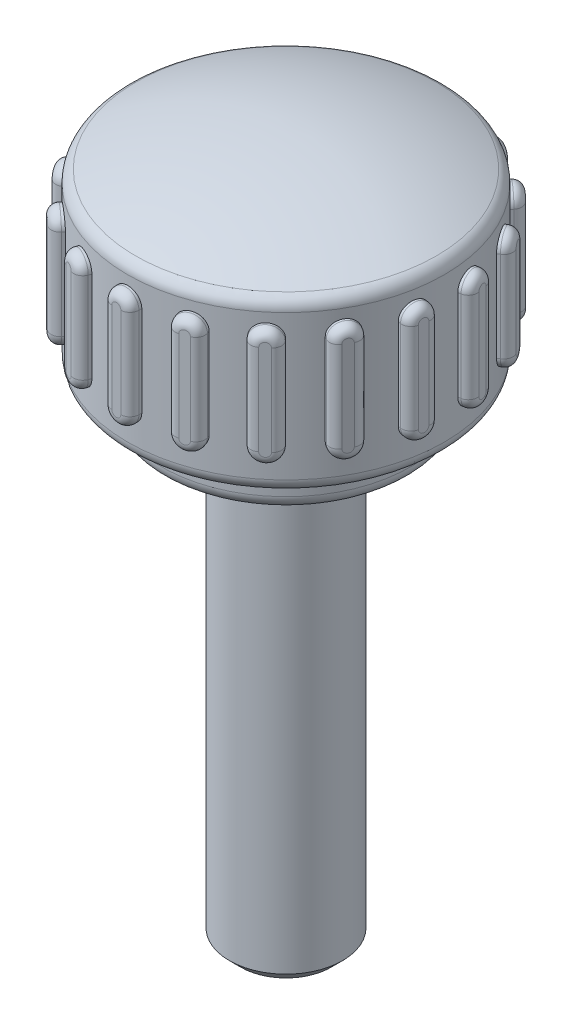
SolidWorks part; units mm, degrees
ref_plane "Face" through (0, 0, 0) normal (0, 0, 1) x (1, 0, 0)
ref_plane "Dessus" through (0, 0, 0) normal (0, 1, 0) x (1, 0, 0)
ref_plane "Droite" through (0, 0, 0) normal (1, 0, 0) x (0, 0, -1)
sketch "Esquisse1" plane through (0, 0, 0) normal (0, 0, 1) x (1, 0, 0)
  line L0 (0, 0) -> (0, 30.9077) construction
  line L1 (0, 0) -> (3.5, 0)
  line L2 (3.5, 0) -> (3.5, 0.3)
  line L3 (3.5, 0.3) -> (5.5, 0.3)
  line L4 (5.5, 0.3) -> (5.5, 2)
  line L5 (5.5, 2) -> (7, 2)
  line L6 (7, 2) -> (7, 9.3875)
  line L7 (0, 0) -> (0, 11)
  arc A0 (7, 9.3875) -> (0, 11) centre (0, -5) ccw
  dimension "D7" = 16
  dimension "D1" = 7
  dimension "D2" = 11
  dimension "D3" = 14
  dimension "D4" = 0.3
  dimension "D5" = 2
  dimension "D6" = 11
revolve "Révolution1" add sketch "Esquisse1" angle 360 about L0
sketch "Esquisse2" plane through (0, 0, 0) normal (0, 0, 1) x (1, 0, 0)
  line L0 (0.6, 8) -> (0.6, 4)
  line L1 (-0.6, 8) -> (-0.6, 4)
  arc A0 (-0.6, 8) -> (0.6, 8) centre (0, 8) cw
  arc A1 (0.6, 4) -> (-0.6, 4) centre (0, 4) cw
  dimension "D1" = 0.6
  dimension "D2" = 4
  dimension "D3" = 4
extrude "Extrusion1" add sketch "Esquisse2" along normal blind 7.5
fillet "Congé1" radius 0.4 4 edges at (0.6, 6, 7.5) (0, 3.4, 7.5) (-0.6, 6, 7.5) (0, 8.6, 7.5)
pattern_circular "Répétition circulaire1" count 18 over 360 about axis through (0, 0, 0) along (0, 1, 0) of "Extrusion1", "Congé1"
fillet "Congé2" radius 0.6 3 edges at (0, 2, -7) (0, 9.3875, -7) (0, 0.3, -5.5)
sketch "Esquisse3" plane through (0, 0, 0) normal (0, -1, 0) x (1, 0, 0)
  line L0 (2.6882, 0) -> (-3.1049, 0) construction
  line L1 (0, 3.2404) -> (0, -3.0945) construction
  circle A0 centre (0, 0) radius 2.5
  dimension "D1" = 5
extrude "Extrusion2" add sketch "Esquisse3" along normal blind 20
chamfer "Chanfrein1" distance 0.5 angle 45 1 edges at (0, -20, -2.5)
